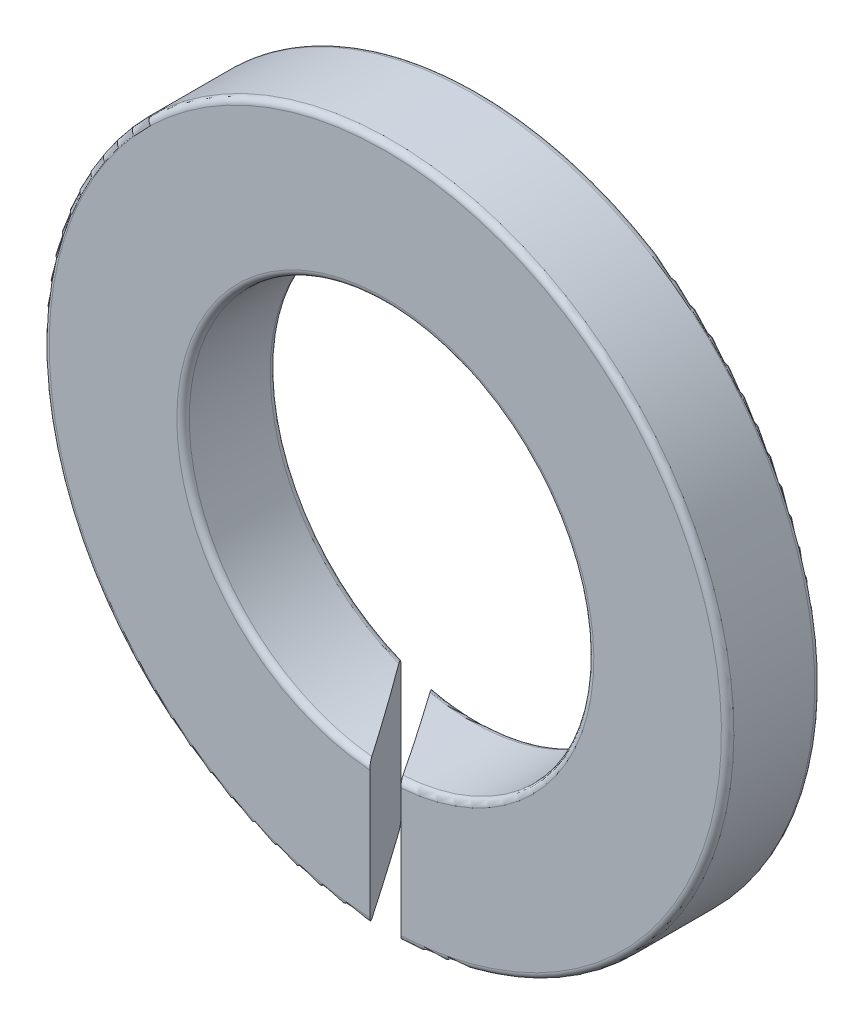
SolidWorks part; units mm, degrees
ref_plane "Face" through (0, 0, 0) normal (0, 0, 1) x (1, 0, 0)
ref_plane "Dessus" through (0, 0, 0) normal (0, 1, 0) x (1, 0, 0)
ref_plane "Droite" through (0, 0, 0) normal (1, 0, 0) x (0, 0, -1)
sketch "Esquisse1" plane through (0, 0, 0) normal (0, 0, 1) x (1, 0, 0)
  circle A0 centre (0, 0) radius 3.25
  circle A1 centre (0, 0) radius 5.5
  dimension "D1" = 11
  dimension "D2" = 6.5
extrude "Base-Extrusion" add sketch "Esquisse1" against normal blind 1.5
sketch "Esquisse2" plane through (0, 0, 0) normal (0, 1, 0) x (1, 0, 0)
  line L0 (-0.25, 0) -> (0.25, 0)
  line L1 (0.25, 0) -> (-0.75, 1.5)
  line L2 (-0.75, 1.5) -> (-1.25, 1.5)
  line L3 (-1.25, 1.5) -> (-0.25, 0)
  line L4 (3.25, 1.5) -> (-3.25, 1.5) construction
  dimension "D1" = 1
  dimension "D2" = 0.5
extrude "Enlèv. mat.-Extru.1" cut sketch "Esquisse2" against normal through all
fillet "Congé1" radius 0.1 4 edges at (0, 3.25, 0) (1.0033, 3.0913, -1.5) (1.0011, 5.4081, -1.5) (0, 5.5, 0)
